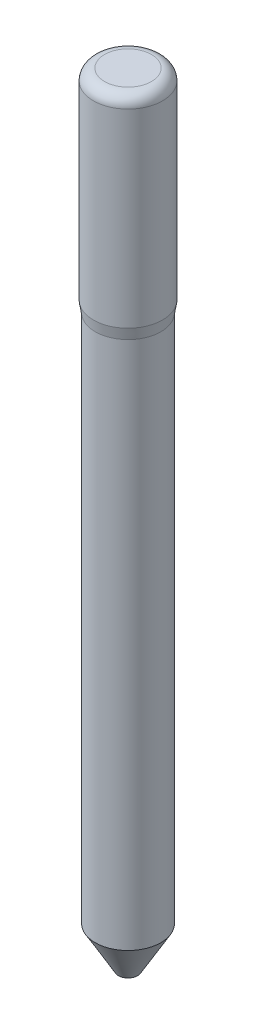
SolidWorks part; units mm, degrees
ref_plane "Front Plane" through (0, 0, 0) normal (0, 0, 1) x (1, 0, 0)
ref_plane "Top Plane" through (0, 0, 0) normal (0, 1, 0) x (1, 0, 0)
ref_plane "Right Plane" through (0, 0, 0) normal (1, 0, 0) x (0, 0, -1)
sketch "Sketch1" plane through (0, 0, 0) normal (0, 0, 1) x (1, 0, 0)
  line L0 (0, 0) -> (0, 18.4135) construction
  line L1 (0, 0) -> (0.2154, 0)
  line L2 (0.2154, 0) -> (0.735, 0.9)
  line L3 (0.735, 0.9) -> (0.735, 12.75)
  line L5 (0.775, 13) -> (0.775, 17.25)
  line L6 (0.525, 17.5) -> (0, 17.5)
  line L7 (0, 17.5) -> (0, 0)
  line L8 (0.775, 13) -> (0.735, 12.75)
  arc A0 (0.775, 17.25) -> (0.525, 17.5) centre (0.525, 17.25) ccw
  dimension "D7" = 0.25
  dimension "D1" = 1.47
  dimension "D2" = 30
  dimension "D3" = 0.9
  dimension "D4" = 1.55
  dimension "D5" = 17.5
  dimension "D6" = 4.5
  dimension "D8" = 0.25
revolve "Revolve1" add sketch "Sketch1" angle 360 about L0
